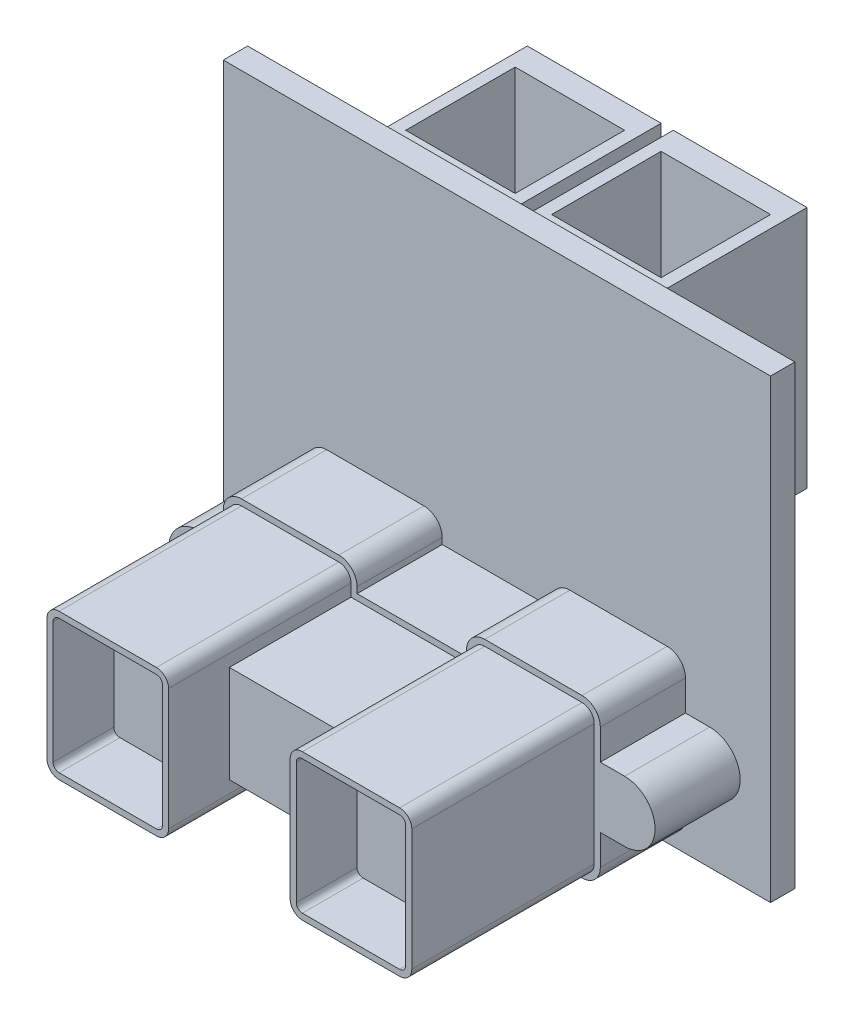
SolidWorks part; units mm, degrees
ref_plane "Front Plane" through (0, 0, 0) normal (0, 0, 1) x (1, 0, 0)
ref_plane "Top Plane" through (0, 0, 0) normal (0, 1, 0) x (1, 0, 0)
ref_plane "Right Plane" through (0, 0, 0) normal (1, 0, 0) x (0, 0, -1)
sketch "Sketch1" plane through (0, 0, 0) normal (0, 0, 1) x (1, 0, 0)
  line L1 (-22.5, 18.75) -> (22.5, 18.75)
  line L2 (-22.5, 18.75) -> (-22.5, -18.75)
  line L3 (-22.5, -18.75) -> (22.5, -18.75)
  line L4 (22.5, 18.75) -> (22.5, -18.75)
  line L5 (-22.5, 18.75) -> (22.5, -18.75) construction
  line L6 (-22.5, -18.75) -> (22.5, 18.75) construction
  point P0 (0, 0)
  dimension "D1" = 37.5
  dimension "D2" = 45
extrude "Boss-Extrude1" add sketch "Sketch1" along normal blind 2
sketch "Sketch2" plane through (0, 0, 2) normal (0, 0, 1) x (1, 0, 0)
  line L0 (0, 18.75) -> (0, -18.75) construction
  line L1 (22.5, 18.75) -> (-22.5, 18.75) construction
  line L2 (-22.5, -18.75) -> (22.5, -18.75) construction
  line L4 (-20, -4.75) -> (20, -4.75)
  line L5 (-20, -4.75) -> (-20, -17.75)
  line L6 (-20, -17.75) -> (20, -17.75)
  line L7 (20, -4.75) -> (20, -17.75)
  line L8 (-20, -4.75) -> (20, -17.75) construction
  line L9 (-20, -17.75) -> (20, -4.75) construction
  point P6 (0, -11.25)
  dimension "D1" = 13
  dimension "D2" = 40
  dimension "D3" = 1
extrude "Boss-Extrude2" add sketch "Sketch2" along normal blind 7
sketch "Sketch3" plane through (0, 0, 9) normal (0, 0, 1) x (1, 0, 0)
  line L0 (0, -4.75) -> (0, -17.75) construction
  line L1 (20, -4.75) -> (-20, -4.75) construction
  line L2 (-20, -17.75) -> (20, -17.75) construction
  line L3 (-5, -7.25) -> (-5, -5.25)
  line L4 (5, -5.25) -> (15, -5.25)
  line L5 (5, -7.25) -> (5, -5.25)
  line L6 (5, -17.25) -> (15, -17.25)
  line L7 (15, -5.25) -> (15, -17.25)
  line L8 (-5, -5.25) -> (-15, -5.25)
  line L9 (5, -15.25) -> (5, -17.25)
  line L10 (-5, -17.25) -> (-15, -17.25)
  line L11 (-15, -5.25) -> (-15, -17.25)
  line L12 (5, -7.25) -> (-5, -7.25)
  line L13 (-5, -15.25) -> (-5, -17.25)
  line L14 (5, -15.25) -> (-5, -15.25)
  line L15 (-20, -17.75) -> (20, -17.75) construction
  point P20 (0, -7.25)
  point P24 (0, -15.25)
  dimension "D1" = 0.5
  dimension "D2" = 0.5
  dimension "D3" = 30
  dimension "D5" = 10
  dimension "D6" = 2
  dimension "D7" = 2
extrude "Boss-Extrude3" add sketch "Sketch3" along normal blind 15
fillet "Fillet1" radius 1 8 edges at (-15, -17.25, 16.5) (-5, -17.25, 16.5) (5, -17.25, 16.5) (-15, -5.25, 16.5) (15, -17.25, 16.5) (15, -5.25, 16.5) (5, -5.25, 16.5) (-5, -5.25, 16.5)
sketch "Sketch4" plane through (0, 0, 24) normal (0, 0, 1) x (1, 0, 0)
  line L0 (-5.5, -14.75) -> (-5.5, -7.75)
  line L1 (5.5, -7.75) -> (5.5, -14.75)
  line L2 (5, -7.25) -> (5, -15.25)
  line L3 (5, -15.25) -> (-5, -15.25)
  line L4 (-5, -15.25) -> (-5, -7.25)
  line L5 (-5, -7.25) -> (5, -7.25)
  line L48 (-14.5, -6.25) -> (-14.5, -16.25)
  line L49 (-14, -16.75) -> (-6, -16.75)
  line L50 (-5.5, -16.25) -> (-5.5, -14.75)
  line L51 (-5.5, -14.75) -> (5.5, -14.75)
  line L52 (5.5, -14.75) -> (5.5, -16.25)
  line L53 (6, -16.75) -> (14, -16.75)
  line L54 (14.5, -16.25) -> (14.5, -6.25)
  line L55 (14, -5.75) -> (6, -5.75)
  line L56 (5.5, -6.25) -> (5.5, -7.75)
  line L57 (5.5, -7.75) -> (-5.5, -7.75)
  line L58 (-5.5, -7.75) -> (-5.5, -6.25)
  line L59 (-6, -5.75) -> (-14, -5.75)
  line L60 (-14.5, -6.25) -> (-14.5, -16.25)
  line L61 (-14, -16.75) -> (-6, -16.75)
  line L62 (-5.5, -16.25) -> (-5.5, -14.75)
  line L63 (-5.5, -14.75) -> (5.5, -14.75) construction
  line L64 (5.5, -14.75) -> (5.5, -16.25)
  line L65 (6, -16.75) -> (14, -16.75)
  line L66 (14.5, -16.25) -> (14.5, -6.25)
  line L67 (14, -5.75) -> (6, -5.75)
  line L68 (5.5, -6.25) -> (5.5, -7.75)
  line L69 (5.5, -7.75) -> (-5.5, -7.75) construction
  line L70 (-5.5, -7.75) -> (-5.5, -6.25)
  line L71 (-6, -5.75) -> (-14, -5.75)
  arc A32 (-14.5, -16.25) -> (-14, -16.75) centre (-14, -16.25) ccw
  arc A33 (-6, -16.75) -> (-5.5, -16.25) centre (-6, -16.25) ccw
  arc A34 (5.5, -16.25) -> (6, -16.75) centre (6, -16.25) ccw
  arc A35 (14, -16.75) -> (14.5, -16.25) centre (14, -16.25) ccw
  arc A36 (14.5, -6.25) -> (14, -5.75) centre (14, -6.25) ccw
  arc A37 (6, -5.75) -> (5.5, -6.25) centre (6, -6.25) ccw
  arc A38 (-5.5, -6.25) -> (-6, -5.75) centre (-6, -6.25) ccw
  arc A39 (-14, -5.75) -> (-14.5, -6.25) centre (-14, -6.25) ccw
  arc A40 (-14.5, -16.25) -> (-14, -16.75) centre (-14, -16.25) ccw
  arc A41 (-6, -16.75) -> (-5.5, -16.25) centre (-6, -16.25) ccw
  arc A42 (5.5, -16.25) -> (6, -16.75) centre (6, -16.25) ccw
  arc A43 (14, -16.75) -> (14.5, -16.25) centre (14, -16.25) ccw
  arc A44 (14.5, -6.25) -> (14, -5.75) centre (14, -6.25) ccw
  arc A45 (6, -5.75) -> (5.5, -6.25) centre (6, -6.25) ccw
  arc A46 (-5.5, -6.25) -> (-6, -5.75) centre (-6, -6.25) ccw
  arc A47 (-14, -5.75) -> (-14.5, -6.25) centre (-14, -6.25) ccw
  dimension "D1" = 0.5
extrude "Cut-Extrude1" cut sketch "Sketch4" against normal blind 5
sketch "Sketch5" plane through (0, 0, 9) normal (0, 0, 1) x (1, 0, 0)
  line L11 (-20, -4.75) -> (-20, -17.75) construction
  line L12 (20, -17.75) -> (20, -4.75) construction
  line L15 (-15.5, -6.25) -> (-15.5, -16.25)
  line L16 (-14, -17.75) -> (-6, -17.75)
  line L17 (6, -17.75) -> (14, -17.75)
  line L18 (-4.5, -15.75) -> (4.5, -15.75)
  line L19 (-4.5, -16.25) -> (-4.5, -15.75)
  line L20 (4.5, -15.75) -> (4.5, -16.25)
  line L21 (-14, -17.75) -> (-6, -17.75)
  line L22 (6, -17.75) -> (14, -17.75)
  line L23 (-4.5, -15.75) -> (4.5, -15.75)
  line L24 (-4.5, -16.25) -> (-4.5, -15.75)
  line L25 (4.5, -15.75) -> (4.5, -16.25)
  line L26 (-15.5, -6.25) -> (-15.5, -16.25) construction
  line L27 (-17.5, -8.75) -> (-15.5, -8.75)
  line L28 (15.5, -16.25) -> (15.5, -6.25)
  line L29 (15.5, -16.25) -> (15.5, -6.25) construction
  line L30 (-15.5, -8.75) -> (-15.5, -6.25)
  line L31 (-17.5, -13.75) -> (-15.5, -13.75)
  line L32 (-15.5, -13.75) -> (-15.5, -16.25)
  line L33 (17.5, -13.75) -> (15.5, -13.75)
  line L34 (15.5, -13.75) -> (15.5, -16.25)
  line L35 (17.5, -8.75) -> (15.5, -8.75)
  line L36 (15.5, -8.75) -> (15.5, -6.25)
  line L51 (20.5, -18.25) -> (20.5, -4.25)
  line L52 (-20.5, -18.25) -> (20.5, -18.25)
  line L53 (-20.5, -4.25) -> (-20.5, -18.25)
  line L54 (20.5, -4.25) -> (-20.5, -4.25)
  line L55 (20.5, -18.25) -> (20.5, -4.25)
  line L56 (-20.5, -18.25) -> (20.5, -18.25)
  line L57 (-20.5, -4.25) -> (-20.5, -18.25)
  line L58 (20.5, -4.25) -> (-20.5, -4.25)
  line L214 (14, -4.75) -> (6, -4.75)
  line L215 (4.5, -6.25) -> (4.5, -6.75)
  line L216 (4.5, -6.75) -> (-4.5, -6.75)
  line L217 (-4.5, -6.75) -> (-4.5, -6.25)
  line L218 (-6, -4.75) -> (-14, -4.75)
  line L219 (14, -4.75) -> (6, -4.75)
  line L220 (4.5, -6.25) -> (4.5, -6.75)
  line L221 (4.5, -6.75) -> (-4.5, -6.75)
  line L222 (-4.5, -6.75) -> (-4.5, -6.25)
  line L223 (-6, -4.75) -> (-14, -4.75)
  circle A4 centre (-17.5, -11.25) radius 2.5 construction
  circle A5 centre (17.5, -11.25) radius 2.5 construction
  arc A6 (-6, -17.75) -> (-4.5, -16.25) centre (-6, -16.25) ccw
  arc A7 (4.5, -16.25) -> (6, -17.75) centre (6, -16.25) ccw
  arc A8 (-6, -17.75) -> (-4.5, -16.25) centre (-6, -16.25) ccw
  arc A9 (4.5, -16.25) -> (6, -17.75) centre (6, -16.25) ccw
  arc A14 (-15.5, -16.25) -> (-14, -17.75) centre (-14, -16.25) ccw
  arc A15 (-14, -4.75) -> (-15.5, -6.25) centre (-14, -6.25) ccw
  arc A16 (-15.5, -16.25) -> (-14, -17.75) centre (-14, -16.25) ccw
  arc A17 (-14, -4.75) -> (-15.5, -6.25) centre (-14, -6.25) ccw
  arc A18 (-17.5, -13.75) -> (-17.5, -8.75) centre (-17.5, -11.25) cw
  arc A19 (17.5, -8.75) -> (17.5, -13.75) centre (17.5, -11.25) cw
  arc A20 (14, -17.75) -> (15.5, -16.25) centre (14, -16.25) ccw
  arc A21 (15.5, -6.25) -> (14, -4.75) centre (14, -6.25) ccw
  arc A22 (14, -17.75) -> (15.5, -16.25) centre (14, -16.25) ccw
  arc A23 (15.5, -6.25) -> (14, -4.75) centre (14, -6.25) ccw
  arc A85 (6, -4.75) -> (4.5, -6.25) centre (6, -6.25) ccw
  arc A86 (-4.5, -6.25) -> (-6, -4.75) centre (-6, -6.25) ccw
  arc A87 (6, -4.75) -> (4.5, -6.25) centre (6, -6.25) ccw
  arc A88 (-4.5, -6.25) -> (-6, -4.75) centre (-6, -6.25) ccw
  point P13 (-20, -11.25)
  dimension "D3" = 5
  dimension "D1" = 0.5
  dimension "D2" = 0.5
  dimension "D4" = 0.5
  dimension "D5" = 0.5
  dimension "D6" = 0.5
extrude "Cut-Extrude2" cut sketch "Sketch5" against normal up to surface (7 mm away)
sketch "Sketch6" plane through (0, 0, 0) normal (0, 0, -1) x (-1, 0, 0)
  line L0 (0, 18.75) -> (0, -18.75) construction
  line L1 (-22.5, 18.75) -> (22.5, 18.75) construction
  line L2 (22.5, -18.75) -> (-22.5, -18.75) construction
  line L3 (-0.5, 18.25) -> (-0.5, -1.75)
  line L4 (-11.5, 18.25) -> (11.5, 18.25) construction
  line L5 (-11.5, 18.25) -> (-11.5, -1.75)
  line L6 (-11.5, -1.75) -> (11.5, -1.75) construction
  line L7 (11.5, 18.25) -> (11.5, -1.75)
  line L8 (-11.5, 18.25) -> (11.5, -1.75) construction
  line L9 (-11.5, -1.75) -> (11.5, 18.25) construction
  line L10 (-0.5, -1.75) -> (-11.5, -1.75)
  line L11 (-11.5, 18.25) -> (-0.5, 18.25)
  line L12 (11.5, 18.25) -> (0.5, 18.25)
  line L13 (0.5, 18.25) -> (0.5, -1.75)
  line L14 (0.5, -1.75) -> (11.5, -1.75)
  point P6 (0, 8.25)
  dimension "D1" = 20
  dimension "D2" = 23
  dimension "D3" = 11
  dimension "D4" = 0.5
extrude "Boss-Extrude5" add sketch "Sketch6" along normal blind 12
sketch "Sketch7" plane through (0, 18.25, 0) normal (0, 1, 0) x (1, 0, 0)
  line L0 (-11.5, 12) -> (-0.5, 12) construction
  line L1 (-10.5, 10) -> (-1.5, 10)
  line L2 (-10.5, 10) -> (-10.5, 1)
  line L3 (-10.5, 1) -> (-1.5, 1)
  line L4 (-1.5, 10) -> (-1.5, 1)
  line L5 (1.5, 10) -> (10.5, 10)
  line L6 (1.5, 10) -> (1.5, 1)
  line L7 (1.5, 1) -> (10.5, 1)
  line L8 (10.5, 10) -> (10.5, 1)
  line L9 (-11.5, 12) -> (-11.5, 0) construction
  line L10 (-0.5, 12) -> (-0.5, 0) construction
  line L11 (0.5, 12) -> (0.5, 0) construction
  line L12 (0.5, 0) -> (11.5, 0) construction
  dimension "D1" = 2
  dimension "D2" = 1
  dimension "D3" = 1
  dimension "D4" = 1
  dimension "D5" = 1
extrude "Cut-Extrude3" cut sketch "Sketch7" against normal blind 12
